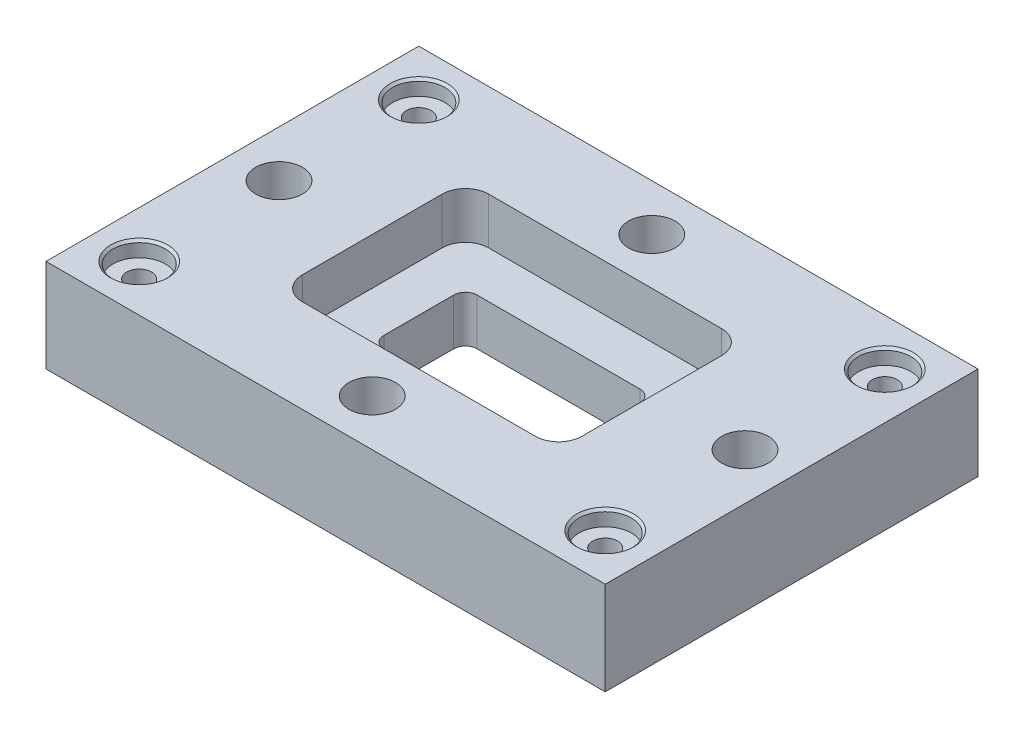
SolidWorks part; units mm, degrees
ref_plane "Front Plane" through (0, 0, 0) normal (0, 0, 1) x (1, 0, 0)
ref_plane "Top Plane" through (0, 0, 0) normal (0, 1, 0) x (1, 0, 0)
ref_plane "Right Plane" through (0, 0, 0) normal (1, 0, 0) x (0, 0, -1)
sketch "Sketch1" plane through (0, 0, 0) normal (0, 1, 0) x (1, 0, 0)
  line L0 (-63.5, 38.1) -> (63.5, 38.1) construction
  line L1 (-76.2, -50.8) -> (76.2, -50.8)
  line L2 (-76.2, -50.8) -> (-76.2, 50.8)
  line L3 (-76.2, 50.8) -> (76.2, 50.8)
  line L4 (76.2, -50.8) -> (76.2, 50.8)
  line L5 (-76.2, -50.8) -> (76.2, 50.8) construction
  line L6 (-76.2, 50.8) -> (76.2, -50.8) construction
  line L7 (63.5, -38.1) -> (63.5, 38.1) construction
  line L8 (-63.5, -38.1) -> (63.5, -38.1) construction
  line L9 (-63.5, -38.1) -> (-63.5, 38.1) construction
  circle A0 centre (-63.5, 0) radius 6.35
  circle A1 centre (63.5, 0) radius 6.35
  circle A2 centre (0, -38.1) radius 6.35
  circle A3 centre (0, 38.1) radius 6.35
  point P0 (0, 0)
  dimension "D4" = 12.7
  dimension "D1" = 152.4
  dimension "D2" = 101.6
  dimension "D3" = 12.7
extrude "Boss-Extrude1" add sketch "Sketch1" along normal blind 25.4
hole_wizard "CBORE for 1/4 Binding Head Machine Screw1" positions "Sketch2" profile "Sketch3" counterbore size "1/4" standard "ANSI Inch"
sketch "Sketch2" plane through (0, 25.4, 0) normal (0, 1, 0) x (1, 0, 0)
  point P0 (-63.5, 38.1)
  point P2 (63.5, 38.1)
  point P4 (63.5, -38.1)
  point P6 (-63.5, -38.1)
sketch "Sketch3" plane through (-63.5, 25.4, -38.1) normal (1, 0, 0) x (0, 0, 1)
  line L0 (0, 0) -> (0, 25.4)
  line L1 (0, 25.4) -> (3.3782, 25.4)
  line L3 (3.3782, 25.4) -> (3.3782, 4.191)
  line L4 (7.1437, 4.191) -> (3.3782, 4.191)
  line L5 (7.1437, 4.191) -> (7.1437, 0.635)
  line L6 (7.1437, 0.635) -> (7.7788, 0)
  line L7 (7.7788, 0) -> (0, 0)
  line L8 (-7.1437, 0.635) -> (-7.7788, 0) construction
  line L11 (0, -6.35) -> (0, 107.95) construction
  dimension "Thru Hole Dia." = 6.7564
  dimension "Thru Hole Depth" = 25.4
  dimension "C'Bore Dia." = 14.2875
  dimension "C'Bore Depth" = 4.191
  dimension "Near C'Sink Dia." = 15.5575
  dimension "Near C'Sink Angle" = 90
sketch "Sketch4" plane through (0, 25.4, 0) normal (0, 1, 0) x (1, 0, 0)
  line L0 (-76.2, -50.8) -> (76.2, 50.8) construction
  line L1 (-38.1, -25.4) -> (38.1, -25.4)
  line L2 (-38.1, -25.4) -> (-38.1, 25.4)
  line L3 (-38.1, 25.4) -> (38.1, 25.4)
  line L4 (38.1, -25.4) -> (38.1, 25.4)
  line L5 (-38.1, -25.4) -> (38.1, 25.4) construction
  line L6 (-38.1, 25.4) -> (38.1, -25.4) construction
  point P0 (0, 0)
  dimension "D1" = 76.2
extrude "Cut-Extrude1" cut sketch "Sketch4" against normal blind 12.7
fillet "Fillet1" radius 6.35 4 edges at (38.1, 19.05, 25.4) (-38.1, 19.05, 25.4) (38.1, 19.05, -25.4) (-38.1, 19.05, -25.4)
sketch "Sketch5" plane through (0, 12.7, 0) normal (0, 1, 0) x (1, 0, 0)
  line L1 (-22.225, -12.7) -> (22.225, -12.7)
  line L2 (-25.4, -9.525) -> (-25.4, 9.525)
  line L3 (-22.225, 12.7) -> (22.225, 12.7)
  line L4 (25.4, -9.525) -> (25.4, 9.525)
  line L5 (-25.4, -12.7) -> (25.4, 12.7) construction
  line L6 (-25.4, 12.7) -> (25.4, -12.7) construction
  arc A0 (-25.4, 9.525) -> (-22.225, 12.7) centre (-22.225, 9.525) cw
  arc A1 (-22.225, -12.7) -> (-25.4, -9.525) centre (-22.225, -9.525) cw
  arc A2 (22.225, -12.7) -> (25.4, -9.525) centre (22.225, -9.525) ccw
  arc A3 (22.225, 12.7) -> (25.4, 9.525) centre (22.225, 9.525) cw
  point P0 (0, 0)
  dimension "D3" = 3.175
  dimension "D1" = 50.8
  dimension "D2" = 25.4
extrude "Cut-Extrude2" cut sketch "Sketch5" against normal through all
